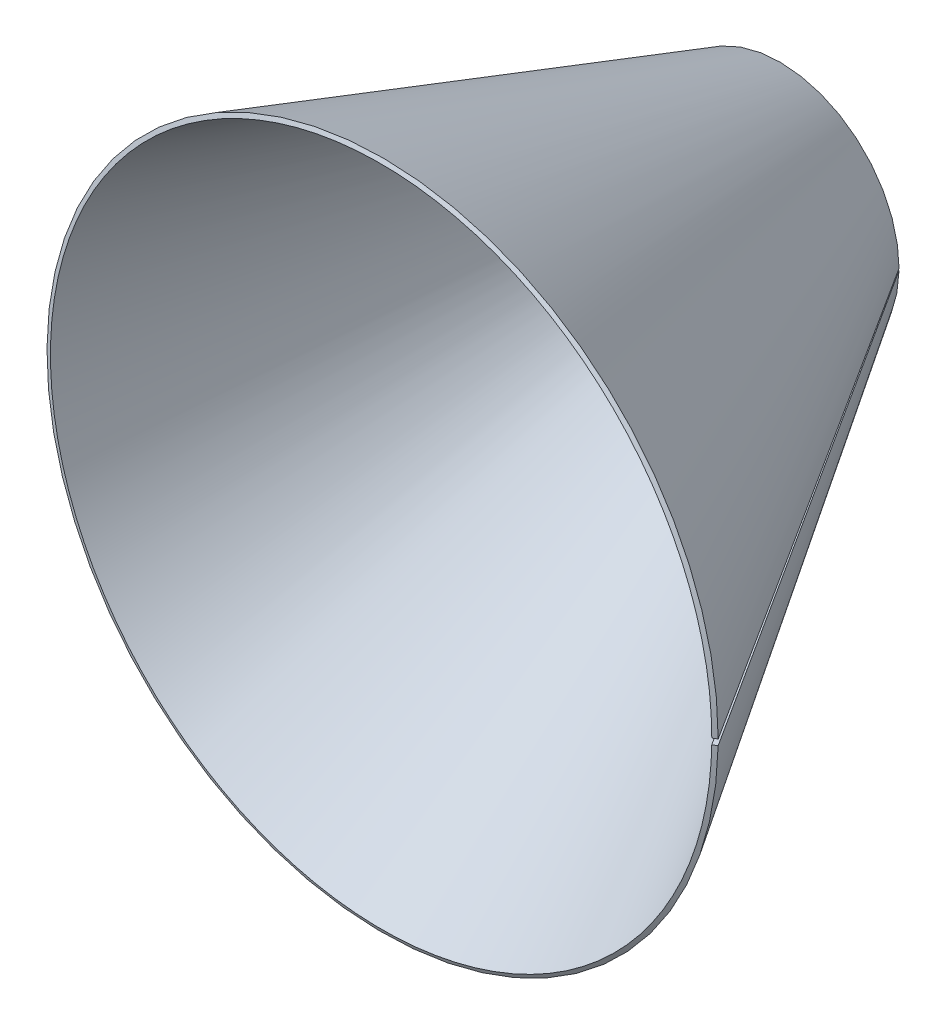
SolidWorks part; units mm, degrees
ref_plane "Ebene vorne" through (0, 0, 0) normal (0, 0, 1) x (1, 0, 0)
ref_plane "Ebene oben" through (0, 0, 0) normal (0, 1, 0) x (1, 0, 0)
ref_plane "Ebene rechts" through (0, 0, 0) normal (1, 0, 0) x (0, 0, -1)
sketch "Skizze1" plane through (0, 0, 0) normal (0, 0, 1) x (1, 0, 0)
  line L0 (0, 0) -> (38.5, 0) construction
  line L1 (38.4941, -0.6719) -> (0, 0) construction
  arc A0 (38.5, 0) -> (38.4941, -0.6719) centre (0, 0) ccw
  dimension "D2" = 38.5
  dimension "D1" = 1
ref_plane "Ebene1" through (0, 0, 161) normal (0, 0, 1) x (1, 0, 0)
sketch "Skizze2" plane through (0, 0, 161) normal (0, 0, 1) x (1, 0, 0)
  line L0 (0, 0) -> (76.8952, 0) construction
  line L1 (32.54, 0) -> (141.04, 0) construction
  line L2 (32.54, 0) -> (141.0235, -1.8936) construction
  arc A0 (141.04, 0) -> (141.0235, -1.8936) centre (32.54, 0) ccw
  point P3 (32.54, 0)
  dimension "D3" = 108.5
  dimension "D1" = 32.54
  dimension "D2" = 1
sheet metal parameters "Blech2" thickness 1.5 parameters "D1"=0.7366, "Dicke"=1.5
lofted bend "Ausgeformte Biegungen2" thickness 1.5 parameters "D1"=0, "D12"=1.5
other "Freiform-Biegung1" parameters "D1"=1000, "D4"=57.296, "D5"=1
flat pattern "Abwicklung1"
sketch "Biegung-Linien1" plane through (0, 0, 0) normal (0, 1, 0) x (-1, 0, 0)
other "Abwickeln-<Freiform-Biegung1>1"
